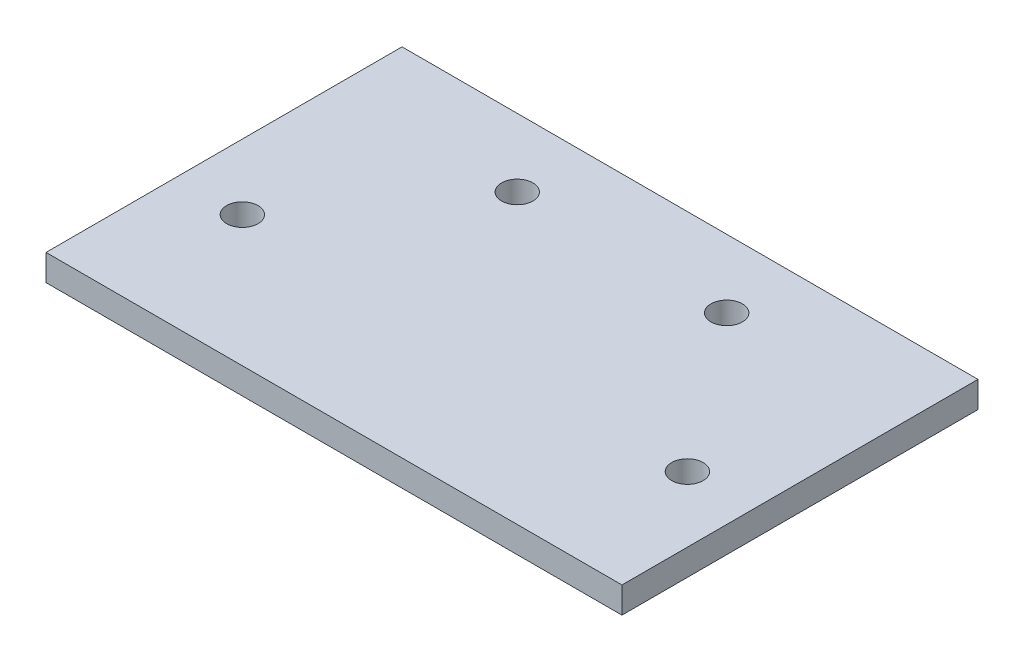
SolidWorks part; units mm, degrees
ref_plane "Front" through (0, 0, 0) normal (0, 0, 1) x (1, 0, 0)
ref_plane "Top" through (0, 0, 0) normal (0, 1, 0) x (1, 0, 0)
ref_plane "Right" through (0, 0, 0) normal (1, 0, 0) x (0, 0, -1)
sketch "Sketch1" plane through (0, 0, 0) normal (0, 1, 0) x (1, 0, 0)
  line L1 (0, 0) -> (110, 0)
  line L2 (0, 0) -> (0, 68)
  line L3 (0, 68) -> (110, 68)
  line L4 (110, 0) -> (110, 68)
  circle A0 centre (35, 55) radius 3
  circle A1 centre (75, 55) radius 3
  circle A2 centre (12.5, 25) radius 3
  circle A3 centre (97.5, 25) radius 3
extrude "Extrude1" add sketch "Sketch1" along normal blind 5
